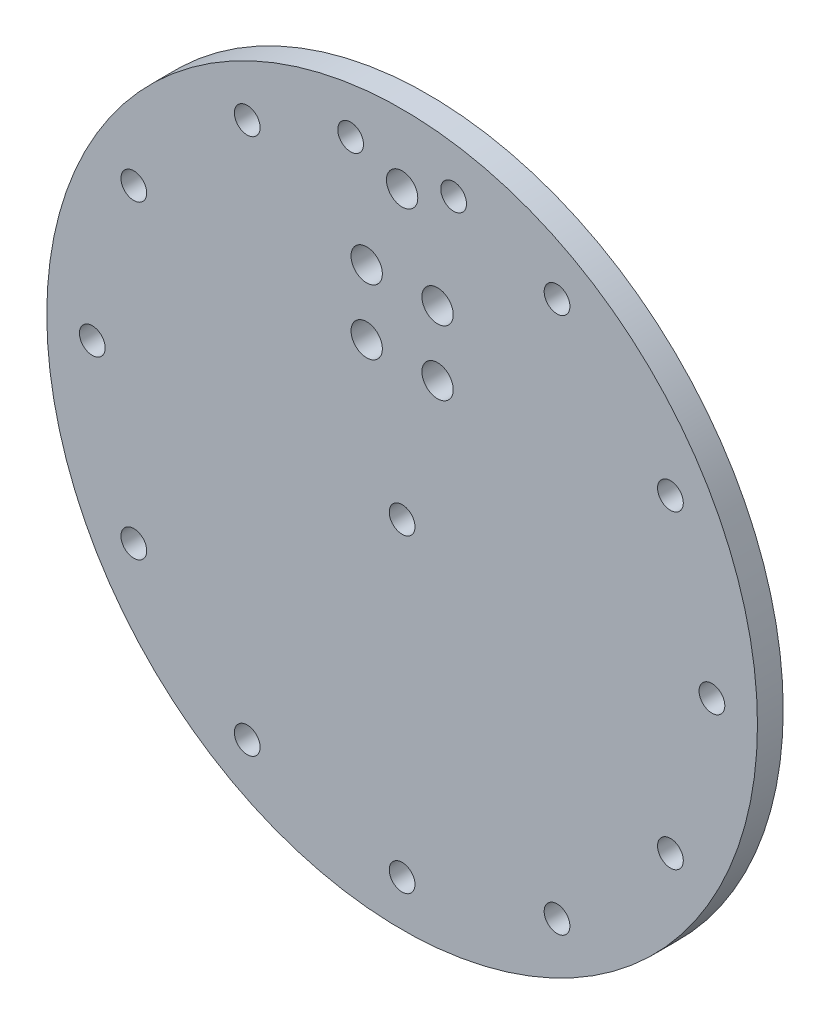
SolidWorks part; units mm, degrees
ref_plane "Front Plane" through (0, 0, 0) normal (0, 0, 1) x (1, 0, 0)
ref_plane "Top Plane" through (0, 0, 0) normal (0, 1, 0) x (1, 0, 0)
ref_plane "Right Plane" through (0, 0, 0) normal (1, 0, 0) x (0, 0, -1)
sketch "Sketch1" plane through (0, 0, 0) normal (0, 0, 1) x (1, 0, 0)
sketch_block_instance "pulley_block_double_cinch-1"
sketch_block "pulley_block_double_cinch"
sketch "Sketch2" plane through (0, 0, 0) normal (0, 0, 1) x (1, 0, 0)
  circle A0 centre (0, 0) radius 43.815 construction
  circle A1 centre (0, 0) radius 43.815
  circle A2 centre (0, 35.2924) radius 1.9304 construction
  circle A3 centre (4.3688, 25) radius 1.9304 construction
  circle A4 centre (4.3688, 17) radius 1.9304 construction
  circle A5 centre (-4.3688, 17) radius 1.9304 construction
  circle A6 centre (6.35, 37.6685) radius 1.5875 construction
  circle A7 centre (-6.35, 37.6685) radius 1.5875 construction
  circle A8 centre (19.1, 33.0822) radius 1.5875 construction
  circle A9 centre (33.0822, 19.1) radius 1.5875 construction
  circle A10 centre (-19.1, 33.0822) radius 1.5875 construction
  circle A11 centre (38.2, 0) radius 1.5875 construction
  circle A12 centre (33.0822, -19.1) radius 1.5875 construction
  circle A13 centre (19.1, -33.0822) radius 1.5875 construction
  circle A14 centre (0, -38.2) radius 1.5875 construction
  circle A15 centre (-19.1, -33.0822) radius 1.5875 construction
  circle A16 centre (-33.0822, -19.1) radius 1.5875 construction
  circle A17 centre (-38.2, 0) radius 1.5875 construction
  circle A18 centre (-33.0822, 19.1) radius 1.5875 construction
  circle A19 centre (0, 0) radius 1.5875 construction
  circle A20 centre (-4.3688, 25) radius 1.9304 construction
  circle A21 centre (-33.0822, -19.1) radius 1.5875
  circle A22 centre (-19.1, -33.0822) radius 1.5875
  circle A23 centre (0, -38.2) radius 1.5875
  circle A24 centre (19.1, -33.0822) radius 1.5875
  circle A25 centre (33.0822, -19.1) radius 1.5875
  circle A26 centre (38.2, 0) radius 1.5875
  circle A27 centre (-38.2, 0) radius 1.5875
  circle A28 centre (-33.0822, 19.1) radius 1.5875
  circle A29 centre (-19.1, 33.0822) radius 1.5875
  circle A30 centre (33.0822, 19.1) radius 1.5875
  circle A31 centre (19.1, 33.0822) radius 1.5875
  circle A32 centre (-6.35, 37.6685) radius 1.5875
  circle A33 centre (-4.3688, 17) radius 1.9304
  circle A34 centre (-4.3688, 25) radius 1.9304
  circle A35 centre (4.3688, 25) radius 1.9304
  circle A36 centre (4.3688, 17) radius 1.9304
  circle A37 centre (0, 35.2924) radius 1.9304
  circle A38 centre (6.35, 37.6685) radius 1.5875
  circle A39 centre (0, 0) radius 1.5875
extrude "Boss-Extrude1" add sketch "Sketch2" along normal blind 3.175
other "Move Face1" [suppressed] parameters "D1"=0.0762
other "Move Face2" [suppressed] parameters "D1"=0.2
equation "\"D22@pulley_block_double_cinch\" = \"D3@pulley_block_double_cinch\""
equation "\"D12@pulley_block_double_cinch\" = \"D1@pulley_block_double_cinch\""
equation "\"D25@pulley_block_double_cinch\" =  - \"D21@pulley_block_double_cinch\""
